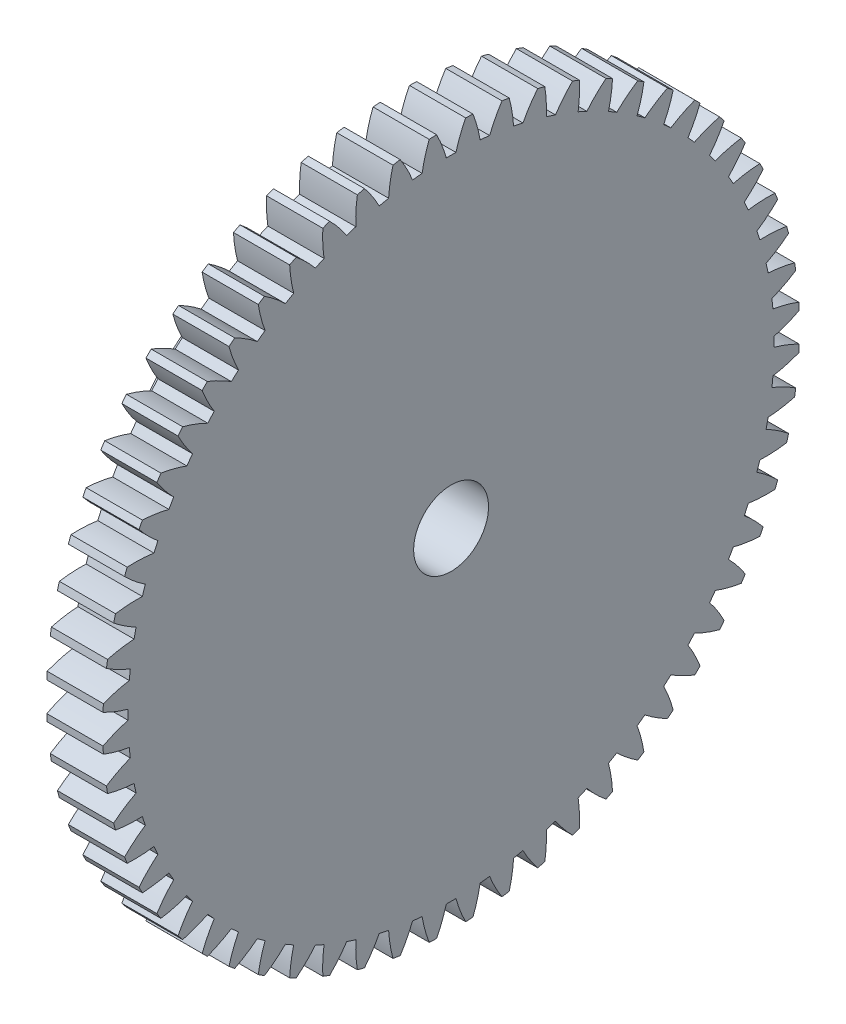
SolidWorks part; units mm, degrees
ref_plane "Plane1" through (0, 0, 0) normal (0, 0, 1) x (1, 0, 0)
ref_plane "Plane2" through (0, 0, 0) normal (0, 1, 0) x (1, 0, 0)
ref_plane "Plane3" through (0, 0, 0) normal (1, 0, 0) x (0, 0, -1)
other "Configuration Table"
sketch "HoldingSke" plane through (0, 0, 0) normal (0, 1, 0) x (1, 0, 0)
  line L0 (0, 0) -> (0.1667, -0.2887)
  line L1 (-15, 0) -> (100, 0) construction
  line L2 (0, 0) -> (-2.1039, 2.3779)
  line L3 (0, 0) -> (-11.863, 4.5341)
  line L4 (0, 0) -> (4.318, 7.479)
  line L5 (0, 0) -> (-46.8476, -17.4728)
  line L6 (0, 0) -> (-12.4344, -8.3896)
  line L7 (-2.1039, 2.3779) -> (8.6587, 51.2062)
  line L8 (-76.2, 54.61) -> (-73.4, 54.61)
  line L9 (-71.009, 38.7566) -> (-53.1078, 45.2721)
  line L10 (-76.2, 71.12) -> (104.1128, 71.12)
  line L11 (0, 0) -> (-15, 0)
  line L12 (-76.2, 101.6) -> (-76.093, 101.6)
  line L13 (24.9733, 27.94) -> (52.9518, 28.4284)
  line L14 (24.9733, 27.94) -> (24.9743, 27.94)
  line L15 (24.9733, 27.94) -> (100.4006, 29.5858)
  line L16 (-63.627, -3) -> (-12.827, -3)
  circle A0 centre (0, 0) radius 10
  circle A1 centre (0, 0) radius 37.5
  circle A2 centre (0, 0) radius 37.5
  circle A3 centre (0, 0) radius 10
sketch "BasProSke" plane through (0, 0, 0) normal (0, 1, 0) x (1, 0, 0)
  line L0 (-10, 0) -> (60, 0) construction
  line L1 (0, 0) -> (0, 93)
  line L2 (0, 0) -> (15, 0)
  line L3 (15, 0) -> (15, 93)
  line L4 (15, 93) -> (0, 93)
revolve "Base-Revolve" add sketch "BasProSke" angle 360 about L0
sketch "TooCutSke" plane through (0, 0, 0) normal (1, 0, 0) x (0, 0, -1)
  line L1 (0, 0) -> (0, 107) construction
  line L2 (0, 0) -> (-2.5432, 89.9641) construction
  line L3 (0, 0) -> (-9.4177, 179.7011) construction
  line L4 (-2.5432, 89.9641) -> (-4.7089, 89.8506) construction
  arc A0 (1.2793, 86.2395) -> (-1.2793, 86.2395) centre (0, 0) ccw
  arc A1 (3.8999, 92.9436) -> (-3.8999, 92.9436) centre (0, 0) ccw
  circle A2 centre (0, 0) radius 90 construction
  circle A3 centre (0, 0) radius 84.5723 construction
  arc A4 (-1.2793, 86.2395) -> (-3.8999, 92.9436) centre (-35.951, 76.5507) ccw
  arc A5 (3.8999, 92.9436) -> (1.2793, 86.2395) centre (35.951, 76.5507) ccw
extrude "ToothCut" cut sketch "TooCutSke" along normal through all
fillet "Breaks" [suppressed] radius 0.06
fillet "RootFillets" [suppressed] radius 0.751
pattern_circular "TeethCuts" count 60 every 6 about axis through (-10, 0, 0) along (1, 0, 0) of "ToothCut"
sketch "HubNeaOneSke" plane through (0, 0, 0) normal (-1, 0, 0) x (0, 0, 1)
  circle A0 centre (0, 0) radius 37.5
extrude "HubNearOne" add sketch "HubNeaOneSke" along normal blind 35.0004
sketch "HubNeaBotSke" plane through (0, 0, 0) normal (-1, 0, 0) x (0, 0, 1)
  circle A0 centre (0, 0) radius 37.5
extrude "HubNearBoth" [suppressed] add sketch "HubNeaBotSke" along normal blind 17.5002
ref_plane "FarPln" through (15, 0, 0) normal (1, 0, 0) x (0, 0, -1)
sketch "HubFarSke" plane through (15, 0, 0) normal (1, 0, 0) x (0, 0, -1)
  circle A0 centre (0, 0) radius 37.5
extrude "HubFar" [suppressed] add sketch "HubFarSke" along normal blind 17.5002
sketch "BorSke" plane through (0, 0, 0) normal (1, 0, 0) x (0, 0, -1)
  circle A0 centre (0, 0) radius 10
extrude "Bore" cut sketch "BorSke" along normal mid plane 100.0007
sketch "KeySke" plane through (0, 0, 0) normal (1, 0, 0) x (0, 0, -1)
  line L0 (-3, 0) -> (-3, 12.8)
  line L1 (-3, 12.8) -> (3, 12.8)
  line L2 (3, 12.8) -> (3, 0)
  line L3 (0, 0) -> (0, 34) construction
  line L4 (-3, 0) -> (3, 0)
extrude "Keyway" [suppressed] cut sketch "KeySke" along normal mid plane 100.0007
pattern_circular "Keyway2" [suppressed] count 2 every 90 about axis through (-10, 0, 0) along (1, 0, 0)
ref_plane "Plan1" through (-35.0004, 0, 0) normal (-1, 0, 0) x (0, 0, 1)
sketch "Esquisse1" plane through (15, 0, 0) normal (1, 0, 0) x (0, 0, -1)
  circle A0 centre (0, 0) radius 25 construction
  circle A1 centre (0, 25) radius 5
equation "' \"Module@HoldingSke\" = 6.35"
equation "' \"Num_teeth@HoldingSke\" = 12"
equation "' \"Ap@HoldingSke\" =  20"
equation "' \"Ap@HoldingSke\" = 20"
equation "' \"Width@HoldingSke\" = 0.5 * 25.4"
equation "' \"Hub_dia@HoldingSke\"= 1 * 25.4"
equation "' \"Hub_dia@HoldingSke\" = 1 * 25.4"
equation "' \"Overall_len@HoldingSke\" = 1.0 * 25.4"
equation "' \"Bore@HoldingSke\" = 0.75 * 25.4"
equation "' \"T_dim@HoldingSke\" = 0.1 * 25.4"
equation "' \"Width@KeySke\" = 0.25 * 25.4"
equation "' \"Show_teeth@HoldingSke\" = 13"
equation "' \"Backlash@HoldingSke\" = 0.009 * 25.4"
equation "' \"Addendum_fac@HoldingSke\" = 1.0"
equation "' \"Dedendum_fac@HoldingSke\" = 1.25"
equation "' \"Dedendum_add@HoldingSke\" = 0.00005 * 25.4"
equation "' \"Clearance_fac@HoldingSke\" = 0.25"
equation "\"Pitch@HoldingSke\" = 1 / \"Module@HoldingSke\""
equation "\"Overcut_dia@TooCutSke\" = (\"Num_teeth@HoldingSke\" + 2 * \"Addendum_fac@HoldingSke\") / \"Pitch@HoldingSke\" + 0.002 * 25.4"
equation "\"Pitch_dia@TooCutSke\" = \"Num_teeth@HoldingSke\" / \"Pitch@HoldingSke\""
equation "\"Base_dia@TooCutSke\" = \"Num_teeth@HoldingSke\" / \"Pitch@HoldingSke\" * cos((\"Ap@HoldingSke\"  * 3.14159265 / 180))"
equation "\"Root_dia@TooCutSke\" = (\"Num_teeth@HoldingSke\" + 2) / \"Pitch@HoldingSke\" - 2 * (\"Addendum_fac@HoldingSke\" + \"Dedendum_fac@HoldingSke\") / \"Pitch@HoldingSke\" - \"Dedendum_add@HoldingSke\" * 2"
equation "\"Half_ang@TooCutSke\" = 180 / \"Num_teeth@HoldingSke\""
equation "\"Half_CT@TooCutSke\" = \"Num_teeth@HoldingSke\" / \"Pitch@HoldingSke\" * sin((3.14159265 / 2 / \"Num_teeth@HoldingSke\")) / 2 - 7 * \"Backlash@HoldingSke\" / 4"
equation "\"Flank_rad@TooCutSke\" = \"Num_teeth@HoldingSke\" / \"Pitch@HoldingSke\" / 5"
equation "\"Radius@RootFillets\" = \"Clearance_fac@HoldingSke\" / \"Pitch@HoldingSke\" + \"Dedendum_add@HoldingSke\""
equation "\"Break_rad@Breaks\" = 0.02 / \"Pitch@HoldingSke\""
equation "\"Thickness@HoldingSke\" = \"Width@HoldingSke\""
equation "\"OAL@HoldingSke\" = \"Thickness@HoldingSke\""
equation "\"MHD@HoldingSke\" = (\"Num_teeth@HoldingSke\" + 2) / \"Pitch@HoldingSke\" - 2 * (\"Addendum_fac@HoldingSke\" + \"Dedendum_fac@HoldingSke\")  / \"Pitch@HoldingSke\" - \"Dedendum_add@HoldingSke\" * 2"
equation "\"MBD@HoldingSke\" = (\"Num_teeth@HoldingSke\" + 2) / \"Pitch@HoldingSke\" - 2 * (\"Addendum_fac@HoldingSke\" + \"Dedendum_fac@HoldingSke\")  / \"Pitch@HoldingSke\" - \"Dedendum_add@HoldingSke\" * 2 - 0.002 * 25.4"
equation "\"MHD@HoldingSke\" = ((sgn( \"MHD@HoldingSke\" - \"Hub_dia@HoldingSke\" )-1)*( \"MHD@HoldingSke\" - \"Hub_dia@HoldingSke\" ))/-2+ \"Hub_dia@HoldingSke\""
equation "\"MBD@HoldingSke\" = ((sgn( \"MBD@HoldingSke\" - \"Bore@HoldingSke\" )-1)*( \"MBD@HoldingSke\" - \"Bore@HoldingSke\" ))/-2+ \"Bore@HoldingSke\""
equation "\"OAL@HoldingSke\" = ((sgn( \"OAL@HoldingSke\" - \"Overall_len@HoldingSke\" )+1)*( \"OAL@HoldingSke\" - \"Overall_len@HoldingSke\" ))/2 + \"Overall_len@HoldingSke\" + 0.000002 * 25.4"
equation "\"Num_teeth@TeethCuts\" = int( \"Show_teeth@HoldingSke\" ) + 1"
equation "\"Num_teeth@TeethCuts\" = ((sgn( \"Num_teeth@TeethCuts\" - \"Num_teeth@HoldingSke\" )-1)*( \"Num_teeth@TeethCuts\" - \"Num_teeth@HoldingSke\" ))/-2+ \"Num_teeth@HoldingSke\""
equation "\"Num_teeth@TeethCuts\" = ((sgn( \"Num_teeth@TeethCuts\" - 2.0)+1)*( \"Num_teeth@TeethCuts\" - 2.0))/2 +2.0"
equation "\"Angle@TeethCuts\" = 360.0 / \"Num_teeth@HoldingSke\""
equation "\"Diameter@BasProSke\" = (\"Num_teeth@HoldingSke\" + 2 * \"Addendum_fac@HoldingSke\") / \"Pitch@HoldingSke\""
equation "\"Thickness@BasProSke\"  = \"Thickness@HoldingSke\""
equation "' \"Fillet_rad@BasProSke\" =  \"Thickness@HoldingSke\" * 0.05"
equation "' \"Fillet_rad@BasProSke\" = \"Thickness@HoldingSke\" * 0.05"
equation "\"MHD@HoldingSke\" = ((sgn( \"MHD@HoldingSke\" - \"Root_dia@TooCutSke\" )-1)*( \"MHD@HoldingSke\" - \"Root_dia@TooCutSke\" ))/-2+ \"Root_dia@TooCutSke\""
equation "\"Diameter@HubNeaOneSke\" = \"MHD@HoldingSke\""
equation "\"Length@HubNearOne\" = \"OAL@HoldingSke\" - \"Thickness@BasProSke\""
equation "\"Diameter@HubNeaBotSke\" = \"MHD@HoldingSke\""
equation "\"Length@HubNearBoth\" = ( \"OAL@HoldingSke\" - \"Thickness@BasProSke\" ) / 2.0"
equation "\"Thickness@FarPln\" = \"Thickness@BasProSke\""
equation "\"Diameter@HubFarSke\" = \"MHD@HoldingSke\""
equation "\"Length@HubFar\" = ( \"OAL@HoldingSke\" - \"Thickness@BasProSke\" ) / 2.0"
equation "\"Diameter@BorSke\" = \"MBD@HoldingSke\""
equation "\"D1@Bore\" = \"OAL@HoldingSke\" * 2.0"
equation "\"D1@Keyway\" = \"OAL@HoldingSke\" * 2.0"
equation "\"Offset@KeySke\" = \"T_dim@HoldingSke\" + \"MBD@HoldingSke\" / 2.0"
